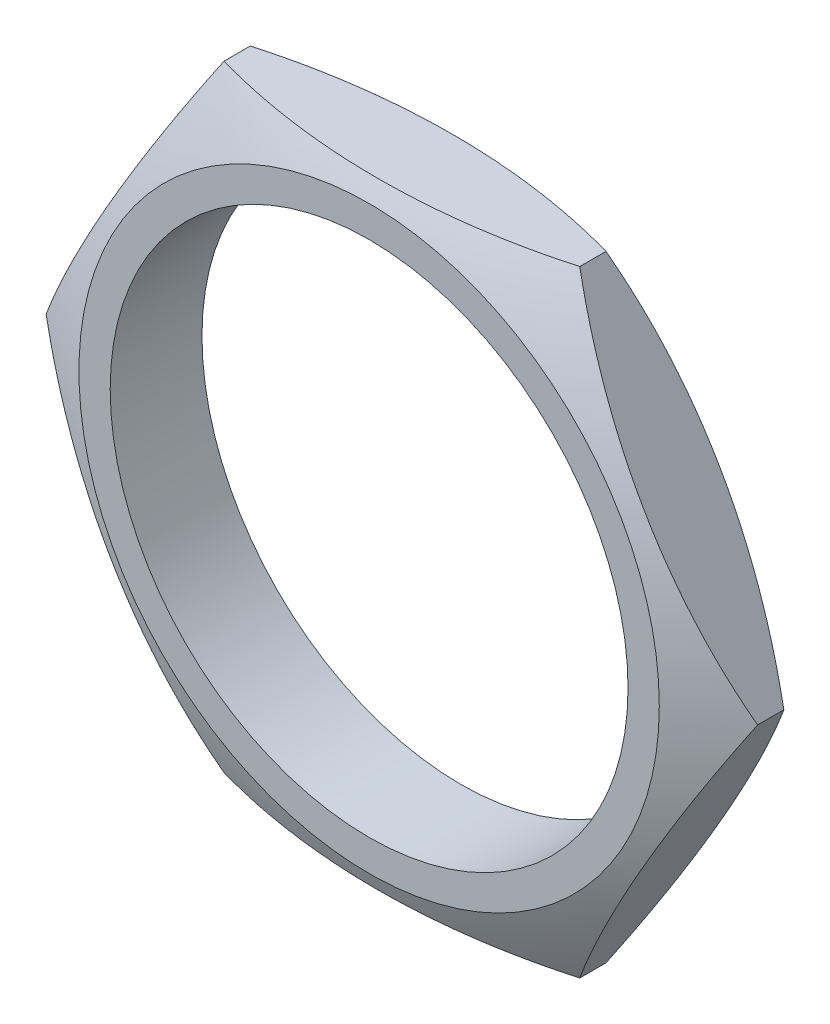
SolidWorks part; units mm, degrees
ref_plane "Plan de face" through (0, 0, 0) normal (0, 0, 1) x (1, 0, 0)
ref_plane "Plan de dessus" through (0, 0, 0) normal (0, 1, 0) x (1, 0, 0)
ref_plane "Plan de droite" through (0, 0, 0) normal (1, 0, 0) x (0, 0, -1)
sketch "Esquisse1" plane through (0, 0, 0) normal (0, 0, 1) x (1, 0, 0)
  line L1 (10.8542, 0) -> (5.4271, 9.4)
  line L2 (5.4271, 9.4) -> (-5.4271, 9.4)
  line L3 (-5.4271, 9.4) -> (-10.8542, 0)
  line L4 (-10.8542, 0) -> (-5.4271, -9.4)
  line L5 (-5.4271, -9.4) -> (5.4271, -9.4)
  line L6 (5.4271, -9.4) -> (10.8542, 0)
  circle A0 centre (0, 0) radius 7.9
  circle A1 centre (0, 0) radius 9.4 construction
  point P3 (0, 0)
  dimension "D2" = 15.8
  dimension "D1" = 18.8
extrude "Boss.-Extru.1" add sketch "Esquisse1" along normal mid plane 2.8
sketch "Esquisse2" plane through (0, 0, 0) normal (0, 1, 0) x (1, 0, 0)
  line L1 (-10.8542, -1.4) -> (-10.8542, 1.4) construction
  line L2 (10.8542, -1.4) -> (10.8542, 1.4) construction
  line L3 (-5.4271, 1.4) -> (-10.8542, 1.4) construction
  line L4 (0, 0) -> (0, 7.365) construction
  line L5 (-10.8542, 0.4) -> (-10.8542, 1.4)
  line L6 (-10.8542, 1.4) -> (10.8542, 1.4)
  line L7 (10.8542, 1.4) -> (10.8542, 0.4)
  arc A0 (-10.8542, 0.4) -> (10.8542, 0.4) centre (0, -18.8084) cw
  point P7 (-8.8542, 1.4)
  dimension "D1" = 1
  dimension "D2" = 2
revolve "Enlèvement de matière-Révolution1" cut sketch "Esquisse2" angle 360 about L4
mirror "Symétrie1" about plane through (0, 0, 0) normal (0, 0, 1) of "Enlèvement de matière-Révolution1"
